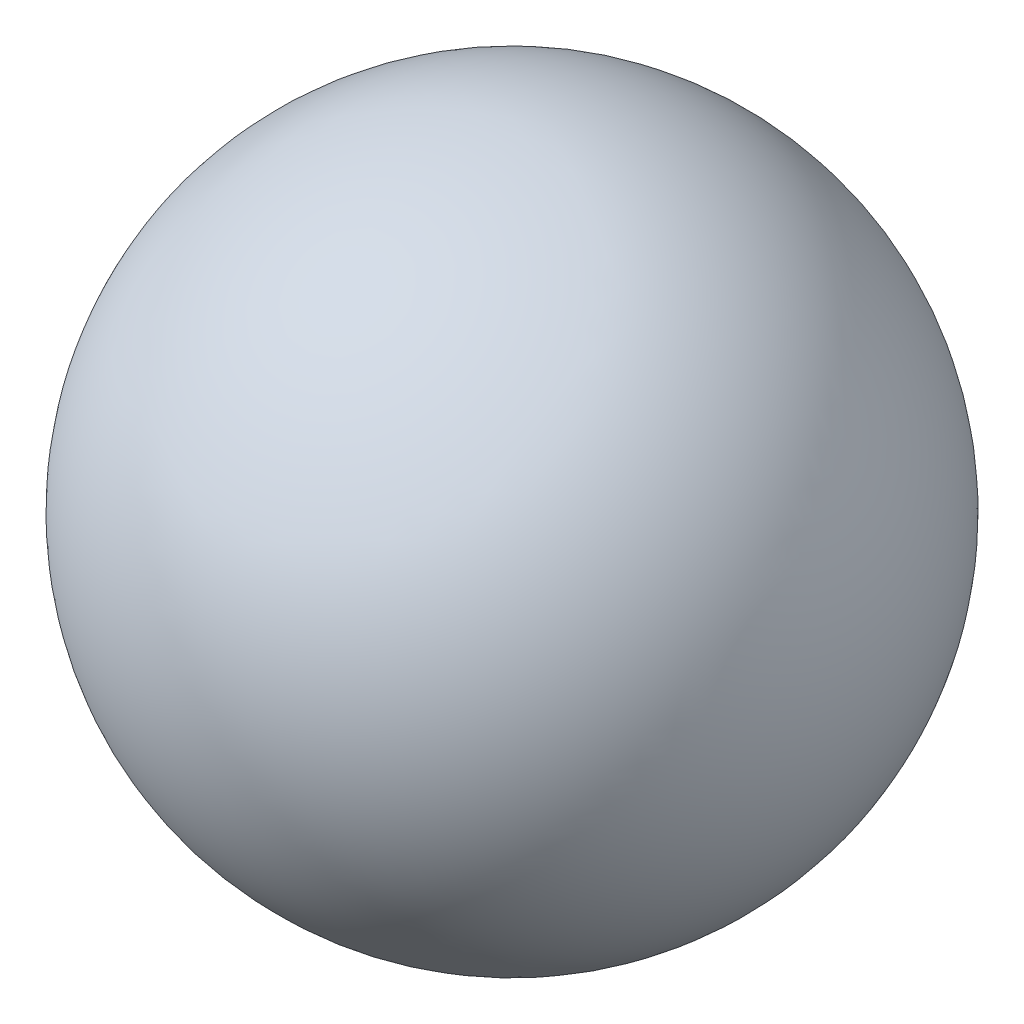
SolidWorks part; units mm, degrees
ref_plane "Plan1" through (0, 0, 0) normal (0, 0, 1) x (1, 0, 0)
ref_plane "Plan2" through (0, 0, 0) normal (0, 1, 0) x (1, 0, 0)
ref_plane "Plan3" through (0, 0, 0) normal (1, 0, 0) x (0, 0, -1)
sketch "Esquisse1" plane through (0, 0, 0) normal (0, 1, 0) x (1, 0, 0)
  line L1 (-1, 5.25) -> (11, 5.25) construction
  line L2 (-1, 10.5) -> (-1, 0) construction
  line L3 (11, 10.5) -> (11, 0) construction
  line L4 (1.25, 5.25) -> (8.75, 5.25)
  circle A1 centre (5, 5.25) radius 3.75 construction
  arc A2 (8.75, 5.25) -> (1.25, 5.25) centre (5, 5.25) ccw
revolve "Base-Révolution" add sketch "Esquisse1" angle 360 about L1
